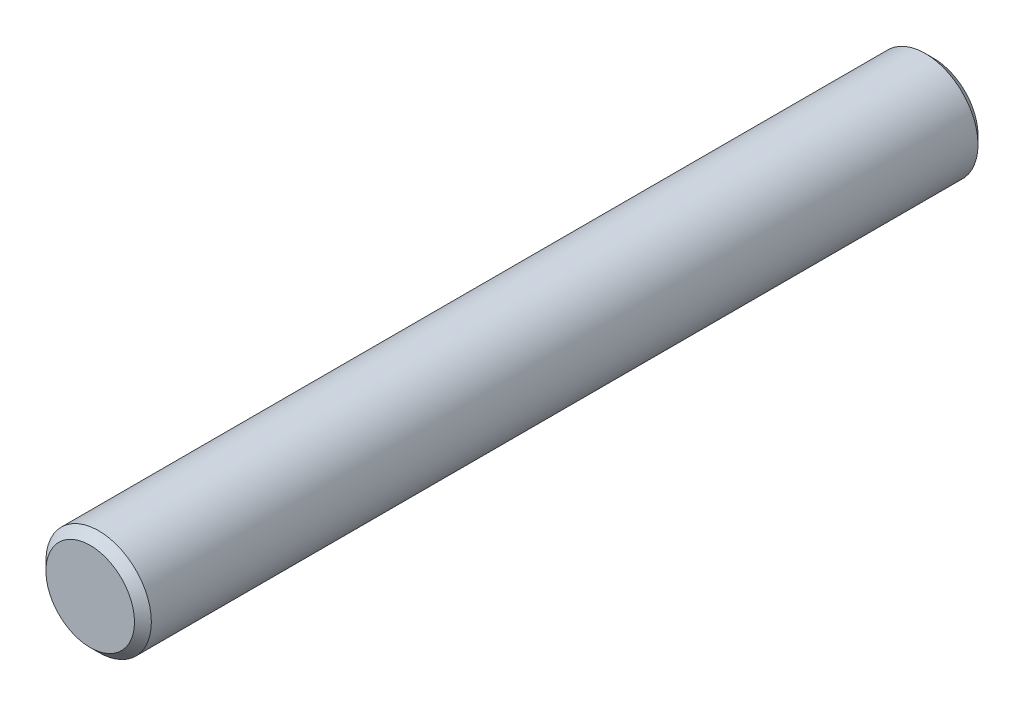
SolidWorks part; units mm, degrees
ref_plane "Front Plane" through (0, 0, 0) normal (0, 0, 1) x (1, 0, 0)
ref_plane "Top Plane" through (0, 0, 0) normal (0, 1, 0) x (1, 0, 0)
ref_plane "Right Plane" through (0, 0, 0) normal (1, 0, 0) x (0, 0, -1)
sketch "Sketch1" plane through (0, 0, 0) normal (0, 0, 1) x (1, 0, 0)
  circle A0 centre (0, 0) radius 1.5875
  dimension "D1" = 3.175
extrude "Boss-Extrude1" add sketch "Sketch1" along normal blind 25.4
chamfer "Chamfer1" distance 0.254 angle 45 2 edges at (1.5875, 0, 0) (1.5875, 0, 25.4)
